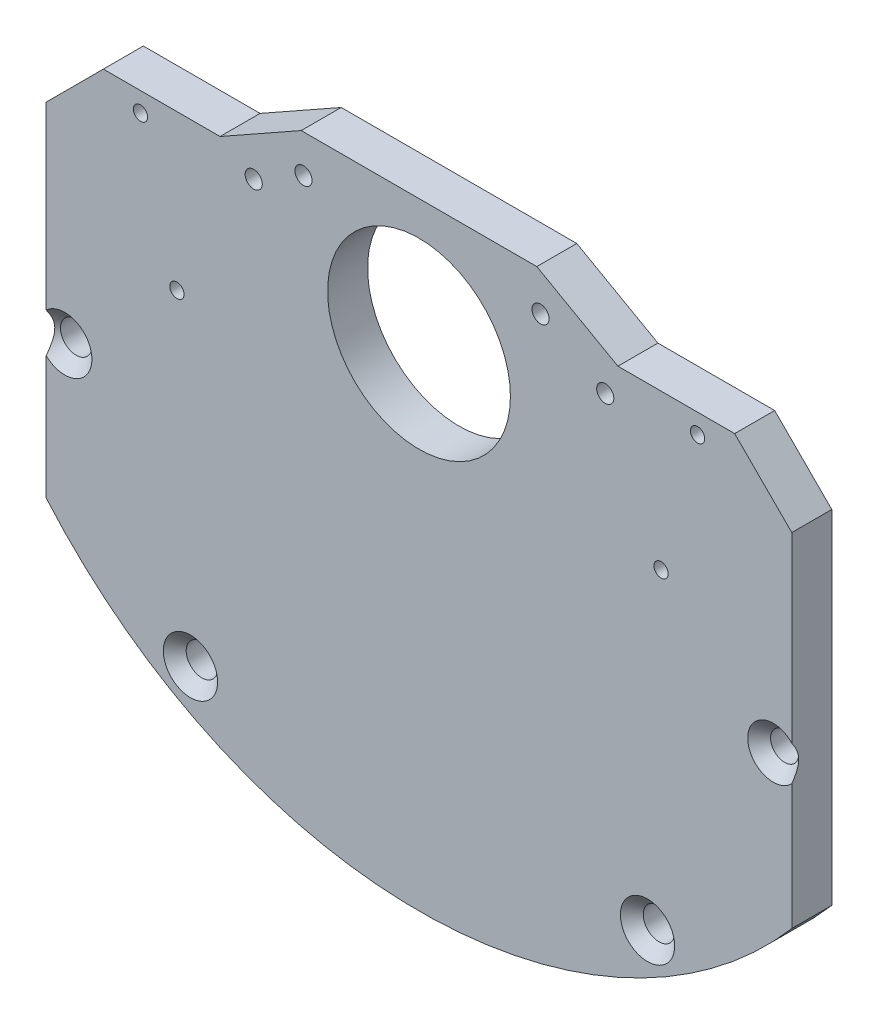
SolidWorks part; units mm, degrees
ref_plane "Plan de face" through (0, 0, 0) normal (0, 0, 1) x (1, 0, 0)
ref_plane "Plan de dessus" through (0, 0, 0) normal (0, 1, 0) x (1, 0, 0)
ref_plane "Plan de droite" through (0, 0, 0) normal (1, 0, 0) x (0, 0, -1)
sketch "Esquisse1" plane through (0, 0, 0) normal (0, 0, 1) x (1, 0, 0)
  line L0 (-60.6442, 0) -> (58.9534, 0) construction
  line L1 (0, 71.2062) -> (0, -63.694) construction
  line L2 (0, 0) -> (19.1342, 46.194) construction
  line L3 (-10, 10) -> (-10, -10)
  line L4 (-10, 10) -> (10, 10)
  line L5 (-63.694, -26.3829) -> (-26.3829, -63.694)
  line L6 (-10, -10) -> (10, -10)
  line L7 (10, 10) -> (10, -10)
  line L8 (26.3829, 63.694) -> (63.694, 26.3829)
  line L9 (26.3829, 63.694) -> (-26.3829, 63.694)
  line L10 (63.694, 26.3829) -> (63.694, -26.3829)
  line L11 (63.694, -26.3829) -> (26.3829, -63.694)
  line L12 (26.3829, -63.694) -> (-26.3829, -63.694)
  line L13 (-63.694, 26.3829) -> (-63.694, -26.3829)
  line L14 (-26.3829, 63.694) -> (-63.694, 26.3829)
  circle A0 centre (19.1342, 46.194) radius 17.5 construction
  circle A1 centre (46.194, 19.1342) radius 17.5 construction
  circle A2 centre (46.194, -19.1342) radius 17.5 construction
  circle A3 centre (19.1342, -46.194) radius 17.5 construction
  circle A4 centre (19.1342, 19.1342) radius 2
  circle A5 centre (19.1342, -19.1342) radius 2
  circle A6 centre (-19.1342, -19.1342) radius 2
  circle A7 centre (-19.1342, 19.1342) radius 2
  circle A28 centre (-19.1342, 46.194) radius 17.5 construction
  circle A29 centre (-46.194, 19.1342) radius 17.5 construction
  circle A30 centre (-46.194, -19.1342) radius 17.5 construction
  circle A31 centre (-19.1342, -46.194) radius 17.5 construction
  point P23 (0, 10)
  point P24 (0, -10)
  point P29 (0, 63.694)
  dimension "D1" = 35
  dimension "D6" = 10
  dimension "D7" = 10
  dimension "D5" = 4
  dimension "D2" = 22.5
  dimension "D3" = 50
  dimension "D8" = 20
  dimension "D4" = 8
extrude "Boss.-Extru.1" [suppressed] add sketch "Esquisse1" along normal blind 3
sketch "Esquisse2" plane through (0, 0, 0) normal (0, 0, 1) x (1, 0, 0)
  line L0 (0, 40.1423) -> (0, -68.4169) construction
  line L1 (-82.3389, 0) -> (88.7863, 0) construction
  line L10 (-17.5, -31) -> (-17.5, -66) construction
  line L11 (17.5, -31) -> (17.5, -66) construction
  line L13 (-48.5, -13.5) -> (-48.5, -48.5) construction
  line L14 (48.5, -13.5) -> (48.5, -48.5) construction
  circle A0 centre (17.5, -66) radius 16.75 construction
  circle A1 centre (48.5, -48.5) radius 16.75 construction
  circle A2 centre (-17.5, -66) radius 16.75 construction
  circle A3 centre (-48.5, -13.5) radius 16.75 construction
  circle A4 centre (-48.5, -48.5) radius 16.75 construction
  circle A5 centre (48.5, -13.5) radius 16.75 construction
  circle A6 centre (17.5, -31) radius 16.75 construction
  circle A7 centre (-17.5, -31) radius 16.75 construction
  circle A8 centre (0, 0) radius 12.3424 construction
  dimension "D2" = 35
  dimension "D1" = 33.5
  dimension "D3" = 35
  dimension "D4" = 17.5
  dimension "D5" = 17.5
  dimension "D6" = 13.5
  dimension "D7" = 13.5
  dimension "D8" = 31
  dimension "D9" = 31
sketch "Esquisse3" plane through (0, 0, 0) normal (0, 0, 1) x (1, 0, 0)
  line L0 (-65.25, 4) -> (-65.25, -56.0218)
  line L1 (65.25, 4) -> (65.25, -56.0218)
  line L2 (-20.6169, 22) -> (20.6169, 22)
  line L3 (20.6169, 22) -> (34.8184, 14)
  line L4 (-20.6169, 22) -> (-34.8184, 14)
  line L5 (-82.3389, 0) -> (88.7863, 0) construction
  line L6 (-55.25, 14) -> (-34.8184, 14)
  line L7 (34.8184, 14) -> (55.25, 14)
  line L8 (55.25, 14) -> (65.25, 4)
  line L9 (-55.25, 14) -> (-65.25, 4)
  arc A0 (-65.25, -56.0218) -> (65.25, -56.0218) centre (0, 0) ccw
  circle A5 centre (0, 0) radius 16
  point P12 (65.25, 14)
  point P13 (-65.25, 14)
  dimension "D1" = 172
  dimension "D2" = 32
  dimension "D3" = 22
  dimension "D4" = 14
  dimension "D7" = 10
  dimension "D8" = 10
extrude "Boss.-Extru.2" add sketch "Esquisse3" along normal blind 7
sketch "Esquisse4" plane through (0, 0, 0) normal (0, 0, -1) x (-1, 0, 0)
  circle A0 centre (-21.2711, 15.1363) radius 1.5
  circle A1 centre (-32.5976, 8.7558) radius 1.5
  circle A2 centre (20.219, 15.3799) radius 1.5
  circle A3 centre (28.9317, 10.4718) radius 1.5
  dimension "D1" = 3
extrude "Enlèv. mat.-Extru.1" cut sketch "Esquisse4" against normal through all
sketch "Esquisse5" plane through (0, 0, 7) normal (0, 0, 1) x (1, 0, 0)
  line L0 (-68.5542, -31) -> (72.2325, -31) construction
  circle A0 centre (-40, -68.9093) radius 2.75
  circle A1 centre (40, -68.9093) radius 2.75
  circle A2 centre (-62, -31) radius 2.75
  circle A3 centre (62, -31) radius 2.4679
  dimension "D1" = 5.5
  dimension "D2" = 40
  dimension "D3" = 40
  dimension "D4" = 62
  dimension "D5" = 62
extrude "Enlèv. mat.-Extru.2" cut sketch "Esquisse5" against normal blind 10
chamfer "Chanfrein1" distance 2 angle 45 4 edges at (64.4679, -31, 7) (42.75, -68.9093, 7) (-37.25, -68.9093, 7) (-59.25, -31, 7)
sketch "Esquisse6" plane through (0, 0, 7) normal (0, 0, 1) x (1, 0, 0)
  line L0 (-47.7229, 0) -> (50.6643, 0) construction
  line L1 (35.4531, 6.2513) -> (0, 0) construction
  line L2 (0, 0) -> (-35.4531, 6.2513) construction
  circle A0 centre (0, 0) radius 36 construction
  dimension "D1" = 72
  dimension "D2" = 10
  dimension "D3" = 10
hole_wizard "Trou taraudé M31" positions "Esquisse8" profile "Esquisse7" tap size "M3" standard "ISO"
sketch "Esquisse8" plane through (0, 0, 7) normal (0, 0, 1) x (1, 0, 0)
  point P1 (-48.7541, 10.5767)
  point P4 (-42.367, -13.0919)
  point P7 (48.7541, 10.5767)
  point P10 (42.367, -13.0919)
sketch "Esquisse7" plane through (-48.7541, 10.5767, 7) normal (1, 0, 0) x (0, -1, 0)
  line L0 (0, 0) -> (0, 7)
  line L1 (0, 7) -> (1.25, 7)
  line L2 (1.25, 7) -> (1.25, 0)
  line L5 (1.25, 0) -> (0, 0)
  line L11 (0, -6.35) -> (0, 107.95) construction
  dimension "Diamètre du trou pour taraudage jusqu'au prochain" = 2.5
  dimension "Profondeur du trou pour taraudage jusqu'au prochain" = 7
